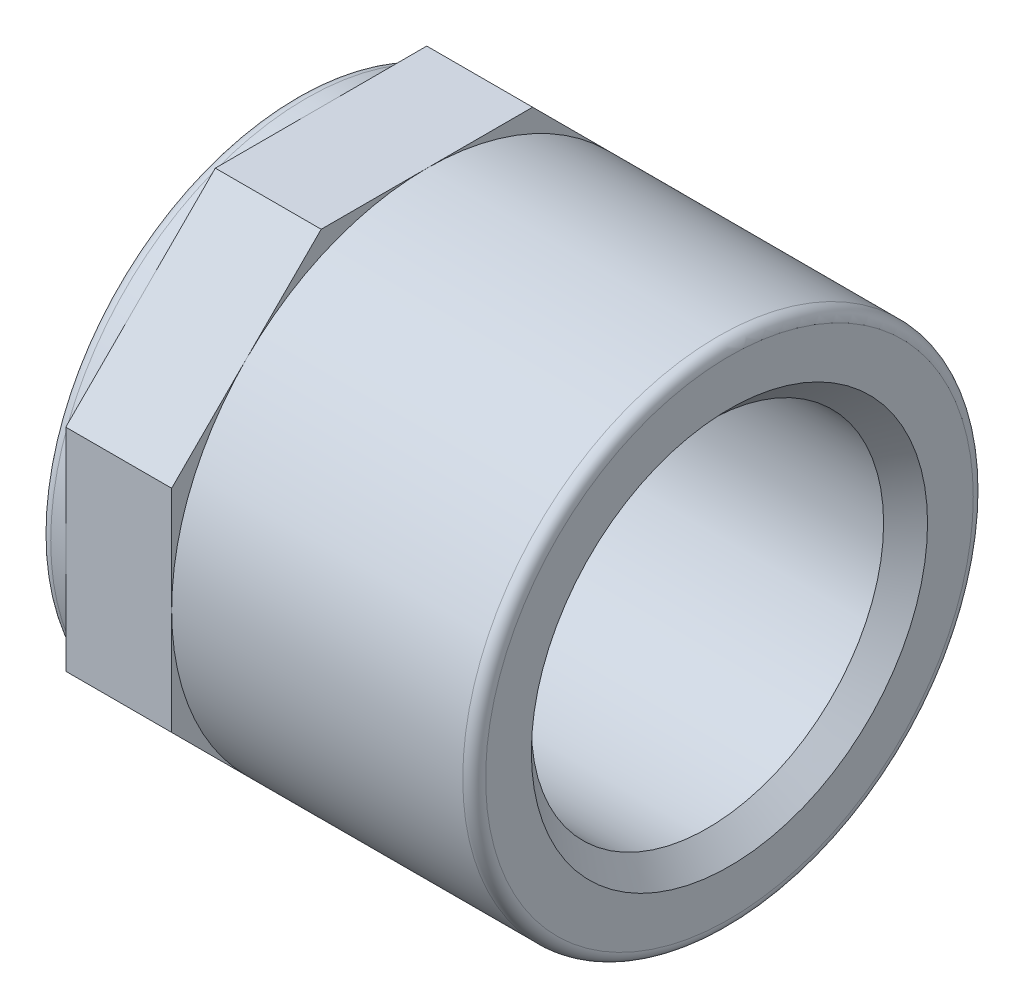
SolidWorks part; units mm, degrees
ref_plane "Front" through (0, 0, 0) normal (0, 0, 1) x (1, 0, 0)
ref_plane "Top" through (0, 0, 0) normal (0, 1, 0) x (1, 0, 0)
ref_plane "Right" through (0, 0, 0) normal (1, 0, 0) x (0, 0, -1)
ref_plane "Plane1" through (-5.6, 0, 0) normal (-1, 0, 0) x (0, -1, 0)
sketch "Sketch1" plane through (-5.6, 0, 0) normal (-1, 0, 0) x (0, -1, 0)
  line L0 (-13.5, -5.5919) -> (-5.5919, -13.5)
  line L1 (-5.5919, -13.5) -> (5.5919, -13.5)
  line L2 (5.5919, -13.5) -> (13.5, -5.5919)
  line L3 (13.5, -5.5919) -> (13.5, 5.5919)
  line L4 (13.5, 5.5919) -> (5.5919, 13.5)
  line L5 (5.5919, 13.5) -> (-5.5919, 13.5)
  line L6 (-5.5919, 13.5) -> (-13.5, 5.5919)
  line L7 (-13.5, 5.5919) -> (-13.5, -5.5919)
extrude "Boss-Extrude1" add sketch "Sketch1" against normal blind 5.6
ref_plane "Plane2" through (0, 0, 0) normal (0, 0, -1) x (-1, 0, 0)
sketch "Sketch2" plane through (0, 0, 0) normal (0, 0, -1) x (-1, 0, 0)
  line L0 (5.6, 13.5) -> (5.6, 0)
  line L1 (5.6, 0) -> (7, 0)
  line L2 (7, 0) -> (7, 13.5)
  line L3 (7, 13.5) -> (5.6, 13.5)
  line L4 (5.6, 0) -> (7, 0) construction
revolve "Revolve1" add sketch "Sketch2" angle 360 about L4
sketch "Sketch3" plane through (0, 0, 0) normal (0, 0, 1) x (1, 0, 0)
  line L0 (0, 13.5) -> (0, 0)
  line L1 (0, 0) -> (16, 0)
  line L2 (16, 0) -> (16, 13.5)
  line L3 (16, 13.5) -> (0, 13.5)
  line L4 (0, 0) -> (16, 0) construction
revolve "Revolve2" add sketch "Sketch3" angle 360 about L4
hole_wizard "M16 Clearance Hole1" positions "Sketch5" profile "Sketch4" hole size "M16" standard "ANSI Metric"
sketch "Sketch5" plane through (16, 0, 0) normal (1, 0, 0) x (0, 0, -1)
  point P0 (0, 0)
sketch "Sketch4" plane through (16, 0, 0) normal (0, 1, 0) x (0, 0, -1)
  line L0 (0, 0) -> (0, 16)
  line L1 (0, 16) -> (9.3155, 16)
  line L2 (9.3155, 16) -> (9.3155, 0)
  line L5 (9.3155, 0) -> (0, 0)
  line L10 (0, 16) -> (-9.3155, 16) construction
  line L11 (0, -6.35) -> (0, 107.95) construction
  dimension "Hole Dia." = 18.631
  dimension "Hole Depth" = 16
  dimension "Drill Angle" = 180
chamfer "Chamfer1" distance 1.162 angle 45 1 edges at (16, 0, -9.3155)
fillet "Fillet1" radius 0.6045 2 edges at (16, 0, -13.5) (-7, 0, 13.5)
